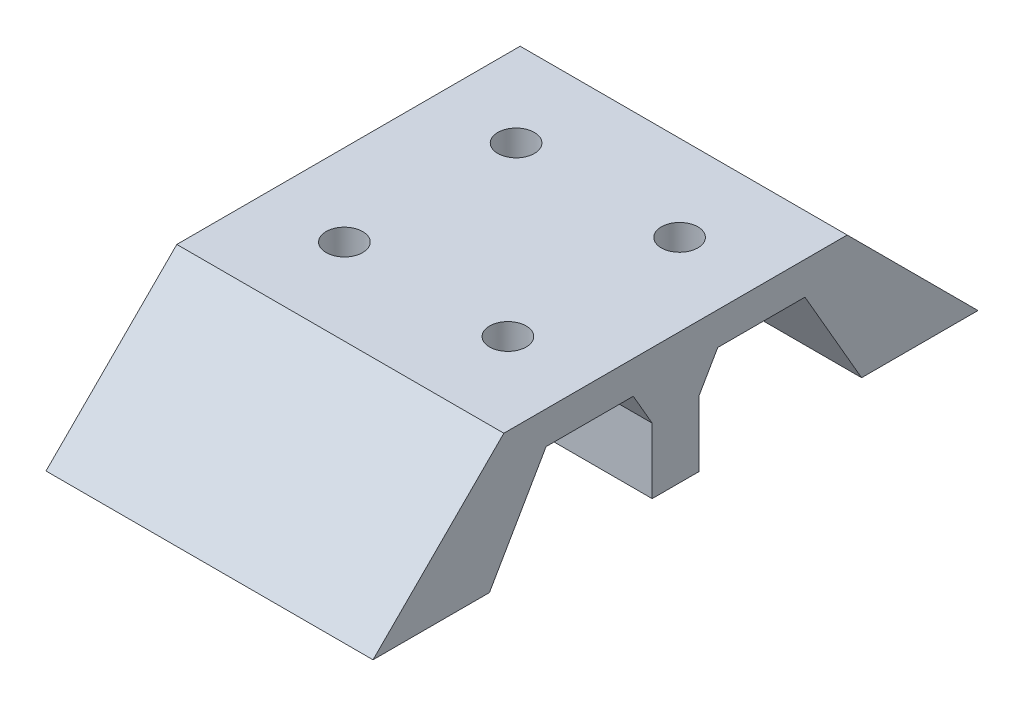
SolidWorks part; units mm, degrees
ref_plane "Front Plane" through (0, 0, 0) normal (0, 0, 1) x (1, 0, 0)
ref_plane "Top Plane" through (0, 0, 0) normal (0, 1, 0) x (1, 0, 0)
ref_plane "Right Plane" through (0, 0, 0) normal (1, 0, 0) x (0, 0, -1)
sketch "Profile" plane through (0, 0, 0) normal (1, 0, 0) x (0, 0, -1)
  line L0 (-20, 4.405) -> (-20, 9.805) construction
  line L1 (-20, 4.405) -> (20, 4.405) construction
  line L2 (-20, 4.405) -> (-20, 24.405) construction
  line L3 (-20, 24.405) -> (20, 24.405) construction
  line L4 (20, 4.405) -> (20, 24.405) construction
  line L5 (-20, 4.405) -> (20, 24.405) construction
  line L6 (-20, 24.405) -> (20, 4.405) construction
  line L7 (-20, 9.805) -> (-18.5, 11.305) construction
  line L8 (-14.5, 10.6126) -> (-14.5, 18.1974) construction
  line L9 (0, 14.405) -> (-20, 14.405) construction
  line L10 (0, 14.405) -> (0, 4.405) construction
  line L11 (-20, 4.405) -> (-14.6, 4.405) construction
  line L12 (-14.6, 4.405) -> (-13.1, 5.905) construction
  line L13 (-13.1, 5.905) -> (-15.5, 5.905) construction
  line L14 (-15.5, 5.905) -> (-15.5, 7.405) construction
  line L15 (-15.5, 7.405) -> (-13.1, 9.905) construction
  line L16 (-13.1, 9.905) -> (-6.9, 9.905) construction
  line L17 (-6.9, 9.905) -> (-4.5, 7.405) construction
  line L18 (-4.5, 7.405) -> (-4.5, 5.905) construction
  line L19 (-4.5, 5.905) -> (-6.9, 5.905) construction
  line L20 (-6.9, 5.905) -> (-5.4, 4.405) construction
  line L21 (-5.4, 4.405) -> (5.4, 4.405) construction
  line L22 (-3, 5.905) -> (-3, 8.0085) construction
  line L23 (-3, 5.905) -> (3, 5.905) construction
  line L24 (0, 5.905) -> (0, 4.405)
  line L25 (-14.5, 14.405) -> (-12.1, 14.405) construction
  line L26 (-7.9, 14.405) -> (-5.5, 14.405) construction
  line L27 (-5.5, 18.1974) -> (-5.5, 10.6126) construction
  line L28 (-5.5, 10.6126) -> (-3, 8.0085) construction
  line L29 (-13.1, 9.905) -> (-13.1, 5.905) construction
  line L30 (-13.1, 5.905) -> (-6.9, 5.905) construction
  line L31 (-6.9, 9.905) -> (-6.9, 5.905) construction
  line L32 (-18.5, 11.305) -> (-18.5, 8.0085) construction
  line L33 (-18.5, 8.0085) -> (-17, 8.0085) construction
  line L34 (-15.5, 7.405) -> (-4.5, 7.405) construction
  line L35 (-17, 8.0085) -> (-14.5, 10.6126) construction
  line L36 (-13.1, 9.905) -> (-6.9, 9.905) construction
  line L37 (-10, 9.905) -> (-10, 14.405) construction
  line L38 (-18.5, 8.0085) -> (-20, 8.0085) construction
  line L39 (-15.5, 5.905) -> (-15.5, 4.405) construction
  line L40 (-4.5, 5.905) -> (-4.5, 4.405) construction
  line L41 (-17, 8.0085) -> (-3, 8.0085) construction
  line L42 (-18.5, 11.305) -> (-20, 11.305) construction
  line L43 (-18.5, 20.8015) -> (-17, 20.8015) construction
  line L44 (-18.5, 17.505) -> (-18.5, 20.8015) construction
  line L45 (-20, 19.005) -> (-18.5, 17.505) construction
  line L46 (-20, 24.405) -> (-20, 19.005) construction
  line L47 (-20, 24.405) -> (-14.6, 24.405) construction
  line L48 (-14.6, 24.405) -> (-13.1, 22.905) construction
  line L49 (-13.1, 22.905) -> (-15.5, 22.905) construction
  line L50 (-15.5, 22.905) -> (-15.5, 21.405) construction
  line L51 (-15.5, 21.405) -> (-13.1, 18.905) construction
  line L52 (-13.1, 18.905) -> (-6.9, 18.905) construction
  line L53 (-6.9, 18.905) -> (-4.5, 21.405) construction
  line L54 (-4.5, 21.405) -> (-4.5, 22.905) construction
  line L55 (-4.5, 22.905) -> (-6.9, 22.905) construction
  line L56 (-6.9, 22.905) -> (-5.4, 24.405) construction
  line L57 (-5.4, 24.405) -> (5.4, 24.405) construction
  line L58 (0, 22.905) -> (0, 24.405)
  line L59 (-3, 22.905) -> (3, 22.905) construction
  line L60 (-3, 22.905) -> (-3, 20.8015) construction
  line L61 (-5.5, 18.1974) -> (-3, 20.8015) construction
  line L62 (-17, 20.8015) -> (-14.5, 18.1974) construction
  line L63 (18.5, 17.505) -> (18.5, 20.8015) construction
  line L64 (20, 19.005) -> (18.5, 17.505) construction
  line L65 (20, 24.405) -> (20, 19.005) construction
  line L66 (20, 24.405) -> (14.6, 24.405) construction
  line L67 (14.6, 24.405) -> (13.1, 22.905) construction
  line L68 (13.1, 22.905) -> (15.5, 22.905) construction
  line L69 (15.5, 22.905) -> (15.5, 21.405) construction
  line L70 (15.5, 21.405) -> (13.1, 18.905) construction
  line L71 (13.1, 18.905) -> (6.9, 18.905) construction
  line L72 (6.9, 18.905) -> (4.5, 21.405) construction
  line L73 (4.5, 21.405) -> (4.5, 22.905) construction
  line L74 (4.5, 22.905) -> (6.9, 22.905) construction
  line L75 (6.9, 22.905) -> (5.4, 24.405) construction
  line L76 (3, 22.905) -> (3, 20.8015) construction
  line L77 (5.5, 18.1974) -> (3, 20.8015) construction
  line L78 (5.5, 18.1974) -> (5.5, 10.6126) construction
  line L79 (5.5, 10.6126) -> (3, 8.0085) construction
  line L80 (3, 5.905) -> (3, 8.0085) construction
  line L81 (6.9, 5.905) -> (5.4, 4.405) construction
  line L82 (4.5, 5.905) -> (6.9, 5.905) construction
  line L83 (4.5, 7.405) -> (4.5, 5.905) construction
  line L84 (6.9, 9.905) -> (4.5, 7.405) construction
  line L85 (13.1, 9.905) -> (6.9, 9.905) construction
  line L86 (15.5, 7.405) -> (13.1, 9.905) construction
  line L87 (15.5, 5.905) -> (15.5, 7.405) construction
  line L88 (13.1, 5.905) -> (15.5, 5.905) construction
  line L89 (14.6, 4.405) -> (13.1, 5.905) construction
  line L90 (20, 4.405) -> (14.6, 4.405) construction
  line L91 (20, 4.405) -> (20, 9.805) construction
  line L92 (20, 9.805) -> (18.5, 11.305) construction
  line L93 (18.5, 11.305) -> (18.5, 8.0085) construction
  line L94 (18.5, 8.0085) -> (17, 8.0085) construction
  line L95 (17, 8.0085) -> (14.5, 10.6126) construction
  line L96 (14.5, 10.6126) -> (14.5, 18.1974) construction
  line L97 (17, 20.8015) -> (14.5, 18.1974) construction
  line L98 (18.5, 20.8015) -> (17, 20.8015) construction
  line L99 (-20, 1.905) -> (-23.81, -1.905)
  line L100 (20, 1.905) -> (-20, 1.905)
  line L101 (20, 1.905) -> (20, -1.905) construction
  line L103 (-20, 1.905) -> (-20, -1.905) construction
  line L104 (20, 1.905) -> (-20, -1.905) construction
  line L105 (20, -1.905) -> (-20, 1.905) construction
  line L106 (-23.81, -1.905) -> (-20, -1.905) construction
  line L107 (20, -1.905) -> (23.81, -1.905) construction
  line L108 (23.81, -1.905) -> (20, 1.905)
  line L115 (14.6, 4.405) -> (14.6, -1.905) construction
  line L116 (5.4, 4.405) -> (5.4, -1.905) construction
  line L117 (-14.6, 4.405) -> (-14.6, -1.905) construction
  line L118 (-5.4, 4.405) -> (-5.4, -1.905) construction
  line L119 (-20, -1.905) -> (-14.6, -1.905) construction
  line L120 (-5.4, -1.905) -> (5.4, -1.905) construction
  line L121 (14.6, -1.905) -> (20, -1.905) construction
  line L122 (14.6, -1.905) -> (5.4, -1.905)
  line L123 (-5.4, -1.905) -> (-14.6, -1.905)
  line L124 (23.81, -1.905) -> (27.62, -5.715)
  line L129 (4.92, -1.905) -> (2.7203, -5.715)
  line L130 (2.7203, -5.715) -> (-2.7203, -5.715) construction
  line L131 (27.62, -5.715) -> (20, -5.715) construction
  line L132 (20, -5.715) -> (20, -1.905) construction
  line L133 (-20, -1.905) -> (-20, -5.715) construction
  line L134 (-20, -5.715) -> (-27.62, -5.715) construction
  line L135 (-27.62, -5.715) -> (-23.81, -1.905)
  line L136 (-2.7203, -5.715) -> (-4.92, -1.905)
  line L137 (20, -5.715) -> (17.2797, -5.715) construction
  line L138 (17.2797, -5.715) -> (15.08, -1.905)
  line L139 (0, 0) -> (0, -5.715) construction
  line L140 (-20, -5.715) -> (-17.2797, -5.715) construction
  line L141 (-17.2797, -5.715) -> (-15.08, -1.905)
  line L142 (15.08, -1.905) -> (14.6, -1.905)
  line L143 (-15.08, -1.905) -> (-14.6, -1.905)
  line L144 (5.4, -1.905) -> (4.92, -1.905)
  line L145 (-4.92, -1.905) -> (-5.4, -1.905)
  line L146 (27.62, -5.715) -> (35.24, -13.335)
  line L147 (17.2797, -5.715) -> (21.6791, -13.335)
  line L148 (21.6791, -13.335) -> (35.24, -13.335)
  line L149 (2.7203, -5.715) -> (2.7203, -13.335)
  line L150 (2.7203, -13.335) -> (-2.7203, -13.335)
  line L151 (-2.7203, -13.335) -> (-2.7203, -5.715)
  line L152 (-17.2797, -5.715) -> (-21.6791, -13.335)
  line L153 (-27.62, -5.715) -> (-35.24, -13.335)
  line L154 (-35.24, -13.335) -> (-21.6791, -13.335)
  circle A0 centre (-10, 14.405) radius 2.1 construction
  circle A1 centre (10, 14.405) radius 2.1 construction
  point P0 (0, 14.405)
  point P97 (-10, -1.905)
  point P105 (0, 0)
  point P106 (10, -1.905)
  dimension "D3" = 2.1
  dimension "D1" = 40
  dimension "D2" = 20
  dimension "D4" = 45
  dimension "D5" = 45
  dimension "D6" = 1.5
  dimension "D7" = 6.2
  dimension "D8" = 11
  dimension "D9" = 45
  dimension "D10" = 10
  dimension "D11" = 1.5
  dimension "D12" = 3.1
  dimension "D13" = 5.5
  dimension "D14" = 5.5
  dimension "D15" = 1.5
  dimension "D16" = 1.5
  dimension "D17" = 3.81
  dimension "D18" = 45
  dimension "D19" = 45
  dimension "D20" = 2.5
  dimension "D21" = 3.81
  dimension "D22" = 5.08
  dimension "D23" = 5.08
  dimension "D24" = 60
  dimension "D25" = 60
  dimension "D26" = 7.62
extrude "Body" add sketch "Profile" along normal blind 38.1
sketch "Hole Layout" plane through (0, -1.905, 0) normal (0, -1, 0) x (1, 0, 0)
  line L0 (0, -10) -> (38.1, -10) construction
  line L2 (38.1, -15.08) -> (38.1, -4.92) construction
  line L3 (19.05, -10) -> (19.05, 10) construction
  line L4 (0, 10) -> (19.05, 10) construction
  line L9 (0, 4.92) -> (0, 15.08) construction
  line L12 (28.575, -10) -> (9.525, -10) construction
  line L13 (28.575, -10) -> (28.575, 10) construction
  line L14 (28.575, 10) -> (9.525, 10) construction
  line L15 (9.525, -10) -> (9.525, 10) construction
  line L16 (28.575, -10) -> (9.525, 10) construction
  line L17 (28.575, 10) -> (9.525, -10) construction
  point P10 (19.05, 0)
hole_wizard "#7 (0.201) Diameter Hole1" positions "Sketch4" profile "Sketch5" hole size "#7" standard "ANSI Inch"
sketch "Sketch4" plane through (0, -1.905, 0) normal (0, -1, 0) x (-1, 0, 0)
  point P32 (-9.525, 10)
  point P35 (-9.525, -10)
  point P38 (-28.575, -10)
  point P41 (-28.575, 10)
sketch "Sketch5" plane through (9.525, -1.905, -10) normal (1, 0, 0) x (0, 0, -1)
  line L0 (0, 0) -> (0, 5.0898)
  line L1 (0, 5.0898) -> (2.5527, 3.556)
  line L2 (2.5527, 3.556) -> (2.5527, 0)
  line L5 (2.5527, 0) -> (0, 0)
  line L10 (0, 5.0898) -> (-2.5527, 3.556) construction
  line L11 (0, -6.35) -> (0, 107.95) construction
  dimension "Hole Dia." = 5.1054
  dimension "Hole Depth" = 3.556
  dimension "Drill Angle" = 118
chamfer "Chamfer1" distance 0.635 angle 30 4 edges at (9.525, -1.905, 7.4473) (28.575, -1.905, 7.4473) (28.575, -1.905, -12.5527) (9.525, -1.905, -12.5527)
